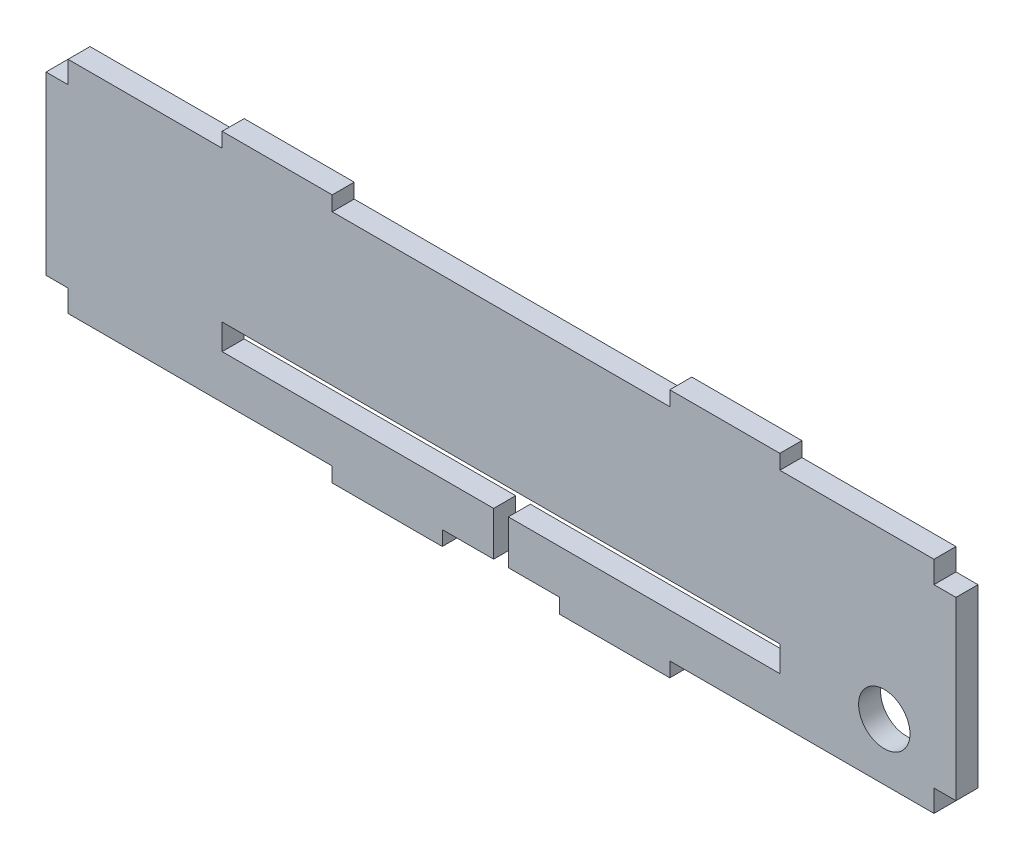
SolidWorks part; units mm, degrees
ref_plane "Front Plane" through (0, 0, 0) normal (0, 0, 1) x (1, 0, 0)
ref_plane "Top Plane" through (0, 0, 0) normal (0, 1, 0) x (1, 0, 0)
ref_plane "Right Plane" through (0, 0, 0) normal (1, 0, 0) x (0, 0, -1)
sketch "Sketch1" plane through (0, 0, 0) normal (0, 0, 1) x (1, 0, 0)
  line L0 (0, 0) -> (0, 43717.3993) construction
  line L1 (-5.9695, 0) -> (43711.4297, 0) construction
  line L2 (3, 0) -> (42, 0)
  line L4 (3, 0) -> (3, 30)
  line L6 (127, 0) -> (127, 30)
  line L7 (42, 0) -> (42, -2)
  line L8 (42, -2) -> (57, -2)
  line L9 (57, -2) -> (57, 0)
  line L10 (57, 0) -> (73, 0)
  line L11 (73, 0) -> (73, -2)
  line L12 (73, -2) -> (88, -2)
  line L13 (88, -2) -> (88, 0)
  line L14 (88, 0) -> (127, 0)
  line L15 (65, 0) -> (65, -50000) construction
  line L16 (27, 9.5) -> (103, 9.5)
  line L17 (27, 9.5) -> (27, 6)
  line L19 (103, 9.5) -> (103, 6)
  line L20 (66, 0) -> (66, 6)
  line L21 (64, 0) -> (66, 0)
  line L22 (64, 0) -> (64, 6)
  line L25 (27, 6) -> (64, 6)
  line L26 (66, 6) -> (103, 6)
  line L27 (3, 30) -> (27, 30)
  line L29 (42, 30) -> (42, 32)
  line L30 (42, 32) -> (27, 32)
  line L31 (27, 30) -> (27, 32)
  line L32 (42, 30) -> (88, 30)
  line L33 (127, 30) -> (103, 30)
  line L34 (103, 30) -> (103, 32)
  line L35 (88, 32) -> (103, 32)
  line L36 (88, 30) -> (88, 32)
  line L37 (127, 3) -> (124, 3)
  line L38 (3, 0) -> (6, 0)
  line L39 (3, 0) -> (3, 3)
  line L40 (3, 3) -> (6, 3)
  line L41 (6, 0) -> (6, 3)
  line L42 (124, 0) -> (124, 3)
  line L43 (127, 0) -> (124, 0)
  line L44 (127, 0) -> (127, 3)
  line L45 (-14.82, 15) -> (49985.18, 15) construction
  line L46 (127, 30) -> (124, 30)
  line L47 (124, 30) -> (124, 27)
  line L48 (127, 27) -> (124, 27)
  line L49 (127, 30) -> (127, 27)
  line L50 (3, 27) -> (6, 27)
  line L51 (6, 30) -> (6, 27)
  line L52 (3, 30) -> (6, 30)
  line L53 (3, 30) -> (3, 27)
  circle A0 centre (117.2288, 7.75) radius 3.5
  point P36 (65, 30)
  dimension "D15" = 7.75
  dimension "D1" = 124
  dimension "D2" = 30
  dimension "D3" = 15
  dimension "D4" = 15
  dimension "D5" = 16
  dimension "D6" = 15
  dimension "D7" = 2
  dimension "D8" = 2
  dimension "D9" = 15
  dimension "D10" = 15
  dimension "D11" = 6
  dimension "D12" = 3.5
  dimension "D13" = 15
  dimension "D14" = 2
  dimension "D16" = 15
  dimension "D17" = 3
  dimension "D18" = 3
  dimension "D19" = 46
extrude "Boss-Extrude3" add sketch "Sketch1" along normal blind 3 contours L36 L32 L29 L30 L31 L27 L4 L2 L7 L8 L9 L10 L22 L25 L17 L16 L19 L26 L20 L11 L12 L13 L14 L6 L33 L34 L35
